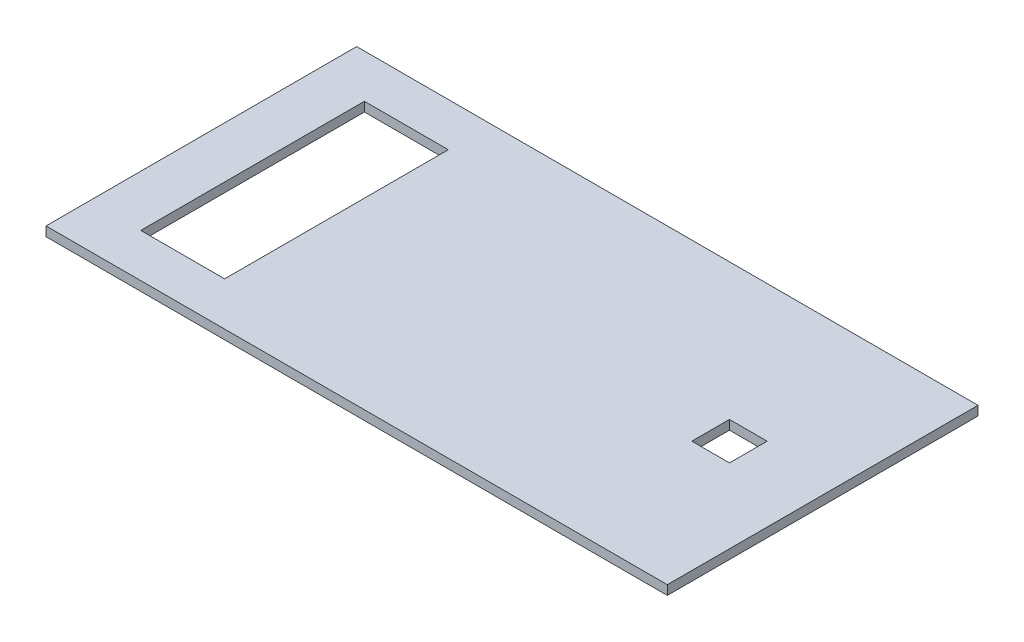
SolidWorks part; units mm, degrees
ref_plane "Front Plane" through (0, 0, 0) normal (0, 0, 1) x (1, 0, 0)
ref_plane "Top Plane" through (0, 0, 0) normal (0, 1, 0) x (1, 0, 0)
ref_plane "Right Plane" through (0, 0, 0) normal (1, 0, 0) x (0, 0, -1)
sketch "Sketch1" plane through (0, 0, 0) normal (0, 0, 1) x (1, 0, 0)
  line L1 (-100, -1.5) -> (100, -1.5)
  line L2 (-100, -1.5) -> (-100, 1.5)
  line L3 (-100, 1.5) -> (100, 1.5)
  line L4 (100, -1.5) -> (100, 1.5)
  line L5 (-100, -1.5) -> (100, 1.5) construction
  line L6 (-100, 1.5) -> (100, -1.5) construction
  point P0 (0, 0)
extrude "Boss-Extrude1" add sketch "Sketch1" along normal blind 100
sketch "Sketch2" plane through (0, 1.5, 0) normal (0, 1, 0) x (1, 0, 0)
  line L0 (-100, -50) -> (-70, -50) construction
  line L1 (-100, -100) -> (-100, 0) construction
  line L2 (100, -50) -> (70, -50) construction
  line L3 (-56.5, -86) -> (-83.5, -86)
  line L4 (-56.5, -86) -> (-56.5, -14)
  line L5 (-56.5, -14) -> (-83.5, -14)
  line L6 (-83.5, -86) -> (-83.5, -14)
  line L7 (-56.5, -86) -> (-83.5, -14) construction
  line L8 (-56.5, -14) -> (-83.5, -86) construction
  line L9 (100, -100) -> (100, 0) construction
  line L11 (63.94, -56.06) -> (76.06, -56.06)
  line L12 (63.94, -56.06) -> (63.94, -43.94)
  line L13 (63.94, -43.94) -> (76.06, -43.94)
  line L14 (76.06, -56.06) -> (76.06, -43.94)
  line L15 (63.94, -56.06) -> (76.06, -43.94) construction
  line L16 (63.94, -43.94) -> (76.06, -56.06) construction
extrude "Cut-Extrude1" cut sketch "Sketch2" against normal blind 100
